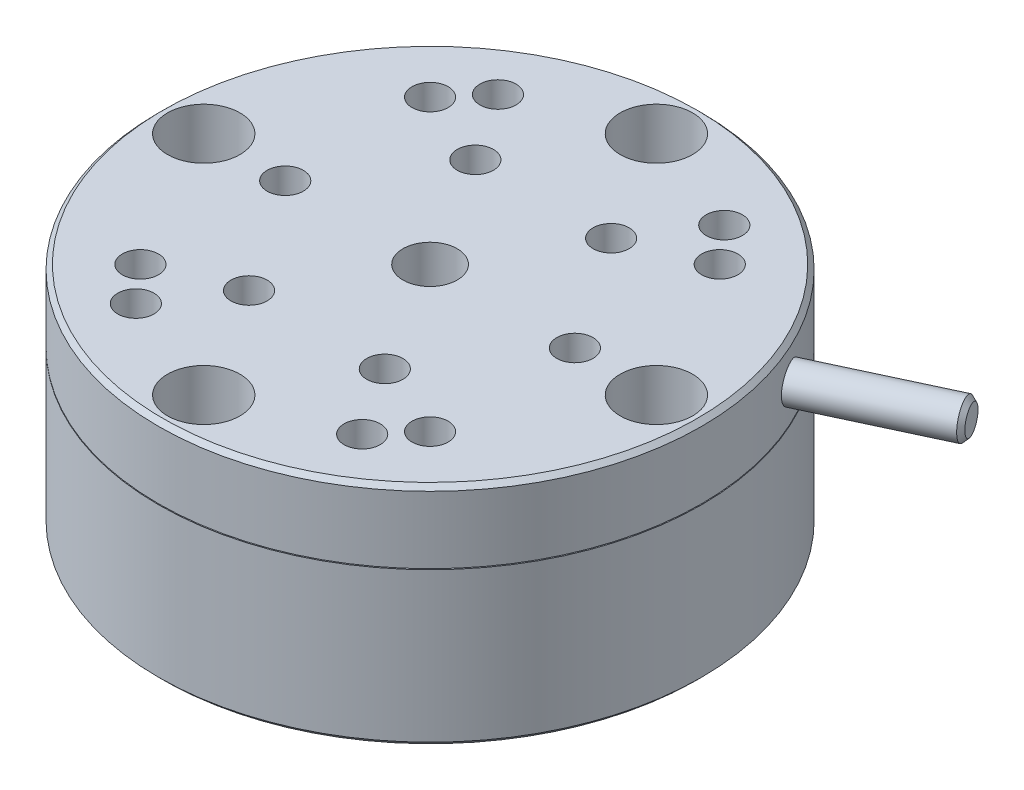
SolidWorks part; units mm, degrees
ref_plane "前基準面" through (0, 0, 0) normal (0, 0, 1) x (1, 0, 0)
ref_plane "上基準面" through (0, 0, 0) normal (0, 1, 0) x (1, 0, 0)
ref_plane "右基準面" through (0, 0, 0) normal (1, 0, 0) x (0, 0, -1)
sketch "草圖1" plane through (0, 0, 0) normal (0, 0, 1) x (1, 0, 0)
  line L0 (0, -48.2184) -> (0, 73.3758) construction
  line L1 (0, 25) -> (0, 0)
  line L2 (0, 0) -> (-29.5, 0)
  line L3 (-30, 0.5) -> (-30, 17)
  line L4 (-29.5, 25) -> (0, 25)
  line L5 (-30, 17.1) -> (-29.5, 17.1)
  line L6 (-29.5, 17.1) -> (-29.5, 17)
  line L7 (-29.5, 17) -> (-30, 17)
  line L8 (-30, 17.1) -> (-30, 24.5)
  line L9 (-30, 24.5) -> (-29.5, 25)
  line L10 (-29.5, 0) -> (-30, 0.5)
  point P6 (-30, 0)
  point P7 (-30, 25)
  dimension "D1" = 0.1
  dimension "D2" = 60
  dimension "D3" = 25
  dimension "D4" = 0.5
  dimension "D5" = 17
  dimension "D8" = 0.5
  dimension "D9" = 0.5
revolve "旋轉1" add sketch "草圖1" angle 360 about L0
hole_wizard "M4 承窩頭蓋螺釘的柱孔2" positions "草圖5" profile "草圖4" counterbore size "M4" standard "JIS"
sketch "草圖5" plane through (0, 25, 0) normal (0, 1, 0) x (-1, 0, 0)
  circle A0 centre (0, 0) radius 25 construction
  point P0 (0, -25)
  point P1 (0, 25)
  point P3 (25, 0)
  point P5 (-25, 0)
  dimension "D1" = 50
sketch "草圖4" plane through (0, 25, -25) normal (1, 0, 0) x (0, 0, 1)
  line L0 (0, 0) -> (0, 25)
  line L1 (0, 25) -> (2.25, 25)
  line L3 (2.25, 25) -> (2.25, 21)
  line L4 (2.25, 21) -> (4, 21)
  line L5 (4, 21) -> (4, 0)
  line L7 (4, 0) -> (0, 0)
  line L11 (0, -6.35) -> (0, 107.95) construction
  dimension "貫穿孔直徑" = 4.5
  dimension "貫穿孔深度" = 25
  dimension "柱孔直徑" = 8
  dimension "柱孔深度" = 21
ref_plane "平面1" through (0, 0, 0) normal (0.7071, 0, -0.7071) x (-0.7071, 0, -0.7071)
sketch "草圖7" plane through (0, 0, 0) normal (0.7071, 0, -0.7071) x (-0.7071, 0, -0.7071)
  line L0 (33, 13) -> (32.5, 12.5)
  line L1 (38.5, 12.5) -> (38, 13)
  line L2 (0, -48.2184) -> (0, 73.3758) construction
  line L3 (0, 11.5) -> (0, 10)
  line L4 (0, 10) -> (38.5, 10)
  line L12 (31.2517, 10) -> (0, 10) construction
  line L14 (38.5, 12.5) -> (38.5, 10)
  line L15 (31.5, 11.5) -> (0, 11.5)
  line L16 (32.5, 12) -> (31.5, 12)
  line L17 (32.5, 12.5) -> (32.5, 12)
  line L20 (31.5, 12) -> (31.5, 11.5)
  line L21 (38, 13) -> (33, 13)
  point P2 (32.5, 13)
  point P5 (38.5, 13)
  dimension "D2" = 6
  dimension "D3" = 3
  dimension "D4" = 4
  dimension "D5" = 6
  dimension "D6" = 38.5
  dimension "D7" = 1
  dimension "D10" = 0.5
  dimension "D11" = 0.5
  dimension "D8" = 10
revolve "旋轉2" add sketch "草圖7" angle 360 about L12
ref_plane "平面2" through (0, 0, 0) normal (0.4226, 0, 0.9063) x (0.9063, 0, -0.4226)
sketch "草圖9" plane through (0, 0, 0) normal (0.4226, 0, 0.9063) x (0.9063, 0, -0.4226)
  line L0 (0, 21) -> (45, 21)
  line L1 (45, 21) -> (45, 19.5)
  line L2 (44.5, 19) -> (0, 19)
  line L3 (0, 21) -> (0, 19)
  line L4 (0, -48.2184) -> (0, 73.3758) construction
  line L6 (13.2843, 21) -> (53.1639, 21) construction
  line L7 (45, 19.5) -> (44.5, 19)
  point P3 (45, 19)
  dimension "D1" = 45
  dimension "D3" = 2
  dimension "D4" = 21
  dimension "D7" = 0.5
revolve "旋轉3" add sketch "草圖9" angle 360 about L6
hole_wizard "Ø4.0 (4) 直徑孔1" positions "草圖11" profile "草圖10" hole size "Ø4.0" standard "JIS"
sketch "草圖11" plane through (0, 25, 0) normal (0, 1, 0) x (-1, 0, 0)
  line L0 (0, 27.581) -> (0, -22.4529) construction
  line L2 (0, 0) -> (29.7963, 0) construction
  point P0 (-7.5, -12.5)
  point P1 (7.5, -12.5)
  point P3 (7.5, 12.5)
  point P5 (-7.5, 12.5)
  dimension "D1" = 25
  dimension "D2" = 15
sketch "草圖10" plane through (7.5, 25, -12.5) normal (1, 0, 0) x (0, 0, 1)
  line L0 (0, 0) -> (0, 6.2017)
  line L1 (0, 6.2017) -> (2, 5)
  line L2 (2, 5) -> (2, 0)
  line L5 (2, 0) -> (0, 0)
  line L10 (0, 6.2017) -> (-2, 5) construction
  line L11 (0, -6.35) -> (0, 107.95) construction
  dimension "鑽孔直徑" = 4
  dimension "鑽孔深度" = 5
  dimension "導頭角度" = 118
hole_wizard "Ø4.0 (4) 直徑孔2" positions "草圖13" profile "草圖12" hole size "Ø4.0" standard "JIS"
sketch "草圖13" plane through (0, 25, 0) normal (0, 1, 0) x (-1, 0, 0)
  line L1 (0, 29.608) -> (0, 0) construction
  line L2 (0, 0) -> (34.917, 0) construction
  point P0 (16, 16)
  point P1 (-16, 16)
  point P3 (-16, -16)
  point P5 (16, -16)
  point P7 (-12.5, -20)
  point P9 (12.5, -20)
  point P11 (-12.5, 20)
  point P13 (12.5, 20)
  point P45 (-16, 0)
  point P47 (16, 0)
  dimension "D1" = 32
  dimension "D2" = 25
  dimension "D3" = 40
  dimension "D4" = 32
sketch "草圖12" plane through (-16, 25, 16) normal (1, 0, 0) x (0, 0, 1)
  line L0 (0, 0) -> (0, 6.2017)
  line L1 (0, 6.2017) -> (2, 5)
  line L2 (2, 5) -> (2, 0)
  line L5 (2, 0) -> (0, 0)
  line L10 (0, 6.2017) -> (-2, 5) construction
  line L11 (0, -6.35) -> (0, 107.95) construction
  dimension "鑽孔直徑" = 4
  dimension "鑽孔深度" = 5
  dimension "導頭角度" = 118
hole_wizard "Ø6.0 (6) 直徑孔1" positions "草圖15" profile "草圖14" hole size "Ø6.0" standard "JIS"
sketch "草圖15" plane through (0, 25, 0) normal (0, 1, 0) x (-1, 0, 0)
  point P1 (0, 0)
sketch "草圖14" plane through (0, 25, 0) normal (1, 0, 0) x (0, 0, 1)
  line L0 (0, 0) -> (0, 15.8026)
  line L1 (0, 15.8026) -> (3, 14)
  line L2 (3, 14) -> (3, 0)
  line L5 (3, 0) -> (0, 0)
  line L10 (0, 15.8026) -> (-3, 14) construction
  line L11 (0, -6.35) -> (0, 107.95) construction
  dimension "鑽孔直徑" = 6
  dimension "鑽孔深度" = 14
  dimension "導頭角度" = 118
